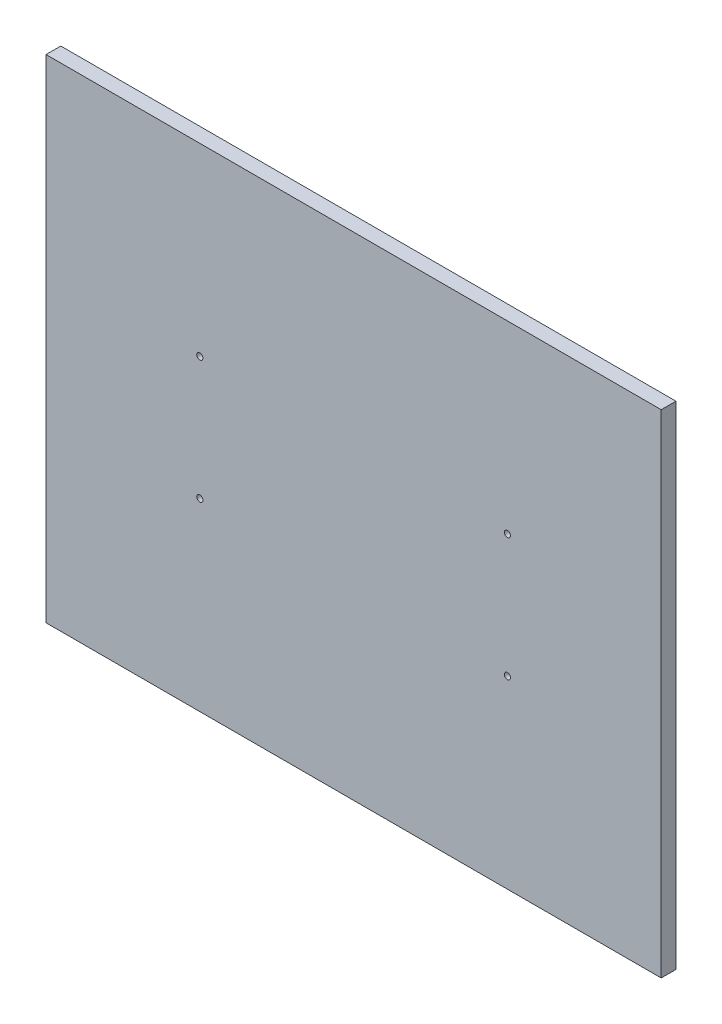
SolidWorks part; units mm, degrees
ref_plane "Plan de face" through (0, 0, 0) normal (0, 0, 1) x (1, 0, 0)
ref_plane "Plan de dessus" through (0, 0, 0) normal (0, 1, 0) x (1, 0, 0)
ref_plane "Plan de droite" through (0, 0, 0) normal (1, 0, 0) x (0, 0, -1)
sketch "Esquisse2" plane through (0, 0, 0) normal (0, 0, 1) x (1, 0, 0)
  line L1 (-125, -100) -> (125, -100)
  line L2 (-125, -100) -> (-125, 100)
  line L3 (-125, 100) -> (125, 100)
  line L4 (125, -100) -> (125, 100)
  line L5 (-125, -100) -> (125, 100) construction
  line L6 (-125, 100) -> (125, -100) construction
  point P0 (0, 0)
  dimension "D1" = 250
  dimension "D2" = 200
extrude "Boss.-Extru.2" add sketch "Esquisse2" along normal blind 6 contours L3 L4 L1 L2
sketch "Esquisse3" plane through (0, 0, 0) normal (0, 0, -1) x (-1, 0, 0)
  circle A0 centre (62.5, 25) radius 1.25
  dimension "D1" = 2.5
  dimension "D2" = 62.5
  dimension "D3" = 25
extrude "Enlèv. mat.-Extru.1" cut sketch "Esquisse3" against normal blind 6
mirror "Symétrie2" about plane through (0, 0, 0) normal (0, 1, 0) of "Enlèv. mat.-Extru.1"
mirror "Symétrie3" about plane through (0, 0, 0) normal (1, 0, 0) of "Symétrie2", "Enlèv. mat.-Extru.1"
sketch "Esquisse4" plane through (0, 0, 6) normal (0, 0, 1) x (1, 0, 0)
  line L0 (-20, 0) -> (20, 0) construction
  line L1 (-20, 100) -> (20, 100)
  line L2 (-20, -100) -> (20, -100)
  arc A0 (-20, 100) -> (-20, -100) centre (-20, 0) ccw
  arc A1 (20, -100) -> (20, 100) centre (20, 0) ccw
  point P2 (0, 0)
  dimension "D1" = 100
  dimension "D2" = 20
